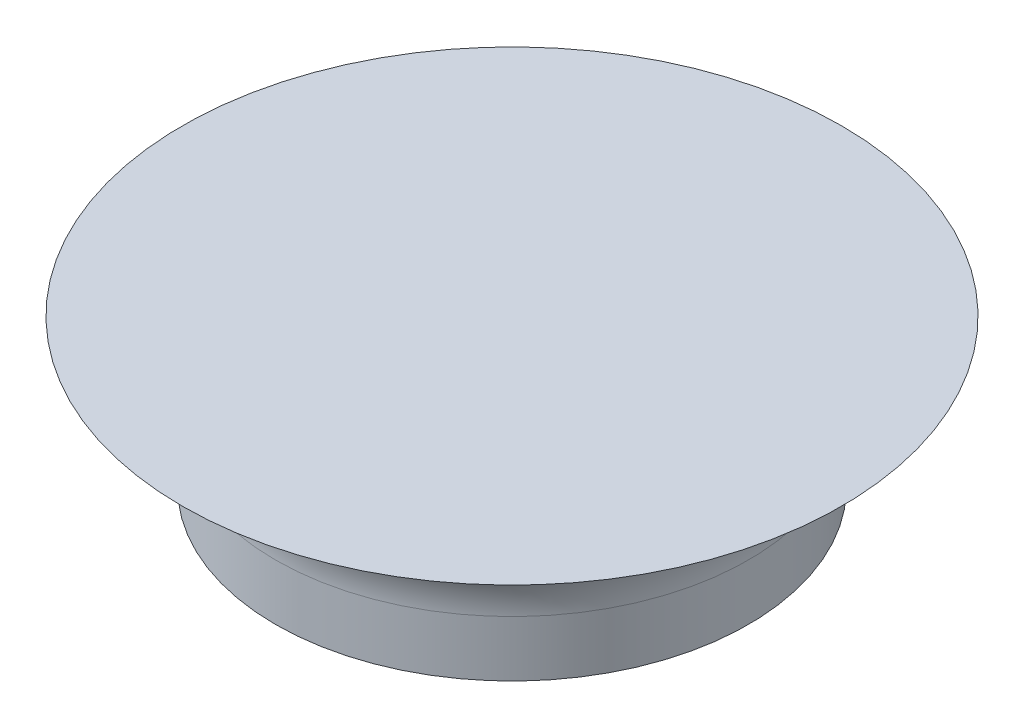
SolidWorks part; units mm, degrees
ref_plane "Plane1" through (0, 0, 0) normal (0, 0, 1) x (1, 0, 0)
ref_plane "Plane2" through (0, 0, 0) normal (0, 1, 0) x (1, 0, 0)
ref_plane "Plane3" through (0, 0, 0) normal (1, 0, 0) x (0, 0, -1)
sketch "Sketch1" plane through (0, 0, 0) normal (0, 0, 1) x (1, 0, 0)
  line L0 (-25, 5) -> (25, 5)
  line L1 (-25, 5) -> (-25, 0)
  line L2 (25, 0) -> (-25, 0)
  line L3 (25, 0) -> (25, 5)
  line L4 (0, 5) -> (0, 0) construction
  line L5 (50, 0) -> (-50, 0) construction
  dimension "D1" = 50
  dimension "D2" = 5
extrude "Base-Extrude" add sketch "Sketch1" along normal mid plane 50
sketch "Sketch5" plane through (0, 0, 0) normal (0, 0, 1) x (1, 0, 0)
  line L0 (0, 0) -> (0, -4.8918) construction
  line L1 (0, 0) -> (6.35, 0)
  line L2 (0, 0) -> (0, -4)
  line L3 (6.35, -4) -> (0, -4)
  line L4 (6.35, -4) -> (6.35, 0)
  dimension "D1" = 12.7
  dimension "Height" = 4
revolve "Boss-Revolve1" add sketch "Sketch5" angle 360 about L0
fillet "Fillet3" radius 2.5 1 edges at (0, 0, 6.35)
sketch "Sketch6" plane through (25, 0, 0) normal (1, 0, 0) x (0, 0, -1)
  line L4 (25, 5) -> (-25, 5)
  line L5 (-25, 5) -> (-25, 0)
  line L6 (-25, 0) -> (25, 0)
  line L7 (25, 0) -> (25, 5)
  line L8 (25, 5) -> (-25, 5)
  line L9 (-25, 5) -> (-25, 0)
  line L10 (-25, 0) -> (25, 0)
  line L11 (25, 0) -> (25, 5)
  dimension "D1" = 0
extrude "Cut-Extrude2" cut sketch "Sketch6" against normal through all
sketch "Orientation sketch" plane through (0, 0, 0) normal (0, 1, 0) x (-1, 0, 0)
  circle A1 centre (0, 0) radius 8.85
  circle A2 centre (0, 0) radius 8.85
  dimension "D1" = 0
